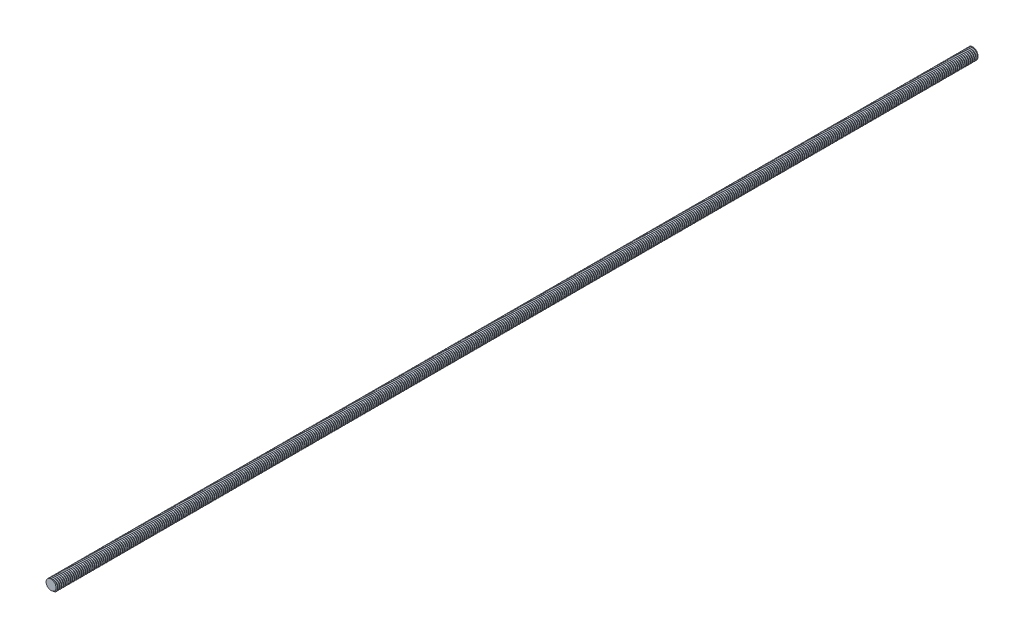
SolidWorks part; units mm, degrees
ref_plane "Plan de face" through (0, 0, 0) normal (0, 0, 1) x (1, 0, 0)
ref_plane "Plan de dessus" through (0, 0, 0) normal (0, 1, 0) x (1, 0, 0)
ref_plane "Plan de droite" through (0, 0, 0) normal (1, 0, 0) x (0, 0, -1)
sketch "Esquisse1" plane through (0, 0, 0) normal (0, 0, 1) x (1, 0, 0)
  circle A0 centre (0, 0) radius 3
  dimension "D1" = 6
extrude "Boss.-Extru.1" add sketch "Esquisse1" along normal blind 500
thread "Filetage3" pitch 1 start angle 0, offset 2, length 0, pitch 1, diameter 6
ref_plane "Plan4" through (-3, 0, 502) normal (0, -1, 0) x (-1, 0, 0)
sketch "Profil de filetage4" plane through (-3, 0, 502) normal (0, -1, 0) x (-1, 0, 0)
  line L0 (0, 0) -> (0, 1) construction
  line L11 (0, 0) -> (0, 0.875)
  line L12 (0, 0.875) -> (-0.5413, 0.5625)
  line L13 (-0.5413, 0.5625) -> (-0.5413, 0.3125)
  line L15 (-0.5413, 0.3125) -> (0, 0)
  line L17 (-0.5413, 0.4375) -> (0, 0.4375) construction
  point P2 (0, 0)
  dimension "Pitch" = 1
  dimension "Profile_Angle" = 60
  dimension "Profile_Land" = 0.25
  dimension "Profile_Height" = 0.5413
